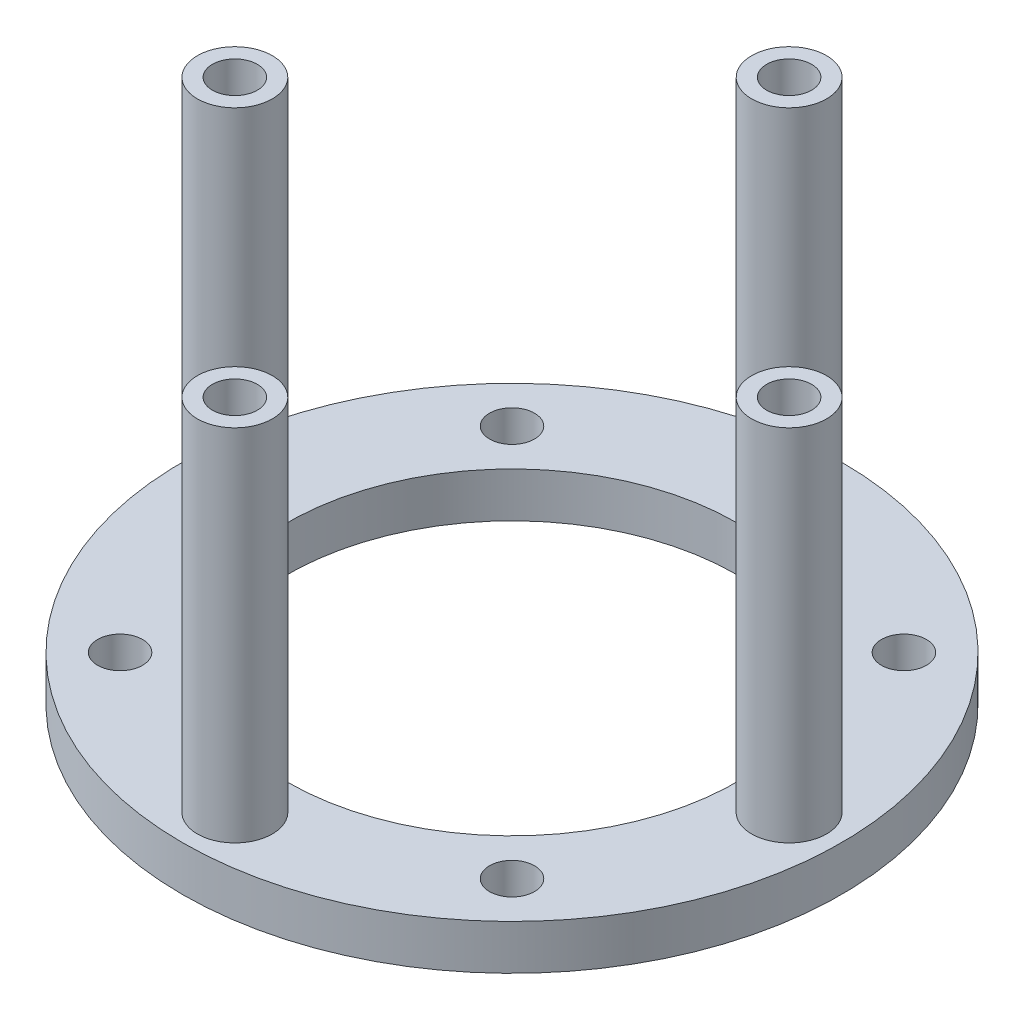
SolidWorks part; units mm, degrees
ref_plane "Front Plane" through (0, 0, 0) normal (0, 0, 1) x (1, 0, 0)
ref_plane "Top Plane" through (0, 0, 0) normal (0, 1, 0) x (1, 0, 0)
ref_plane "Right Plane" through (0, 0, 0) normal (1, 0, 0) x (0, 0, -1)
sketch "Sketch1" plane through (0, 0, 0) normal (0, 1, 0) x (1, 0, 0)
  circle A0 centre (0, 0) radius 22
  circle A1 centre (0, 0) radius 15
  dimension "D1" = 30
  dimension "D2" = 44
extrude "Boss-Extrude1" add sketch "Sketch1" along normal blind 3
sketch "Sketch3" plane through (0, 3, 0) normal (0, 1, 0) x (1, 0, 0)
  circle A0 centre (0, 18.5) radius 2.5
  circle A1 centre (18.5, 0) radius 2.5
  circle A2 centre (0, -18.5) radius 2.5
  circle A3 centre (-18.5, 0) radius 2.5
  point P12 (0, 0)
  dimension "D1" = 5
  dimension "D2" = 18.5
  dimension "D3" = 4
extrude "Boss-Extrude2" add sketch "Sketch3" along normal blind 24
sketch "Sketch4" plane through (0, 27, 0) normal (0, 1, 0) x (1, 0, 0)
  circle A0 centre (-18.5, 0) radius 1.5
  circle A1 centre (0, 18.5) radius 1.5
  circle A2 centre (18.5, 0) radius 1.5
  circle A3 centre (0, -18.5) radius 1.5
  dimension "D1" = 3
  dimension "D2" = 3
  dimension "D3" = 3
  dimension "D4" = 3
extrude "Cut-Extrude1" cut sketch "Sketch4" against normal blind 6
sketch "Sketch5" plane through (0, 3, 0) normal (0, 1, 0) x (1, 0, 0)
  line L0 (0, 0) -> (13.0815, 13.0815) construction
  line L1 (0, 0) -> (18.47, 0) construction
  circle A0 centre (13.0815, 13.0815) radius 1.5
  circle A1 centre (13.0815, -13.0815) radius 1.5
  circle A2 centre (-13.0815, -13.0815) radius 1.5
  circle A3 centre (-13.0815, 13.0815) radius 1.5
  point P15 (0, 0)
  dimension "D3" = 3
  dimension "D1" = 45
  dimension "D2" = 18.5
  dimension "D4" = 4
extrude "Cut-Extrude2" cut sketch "Sketch5" against normal blind 6
